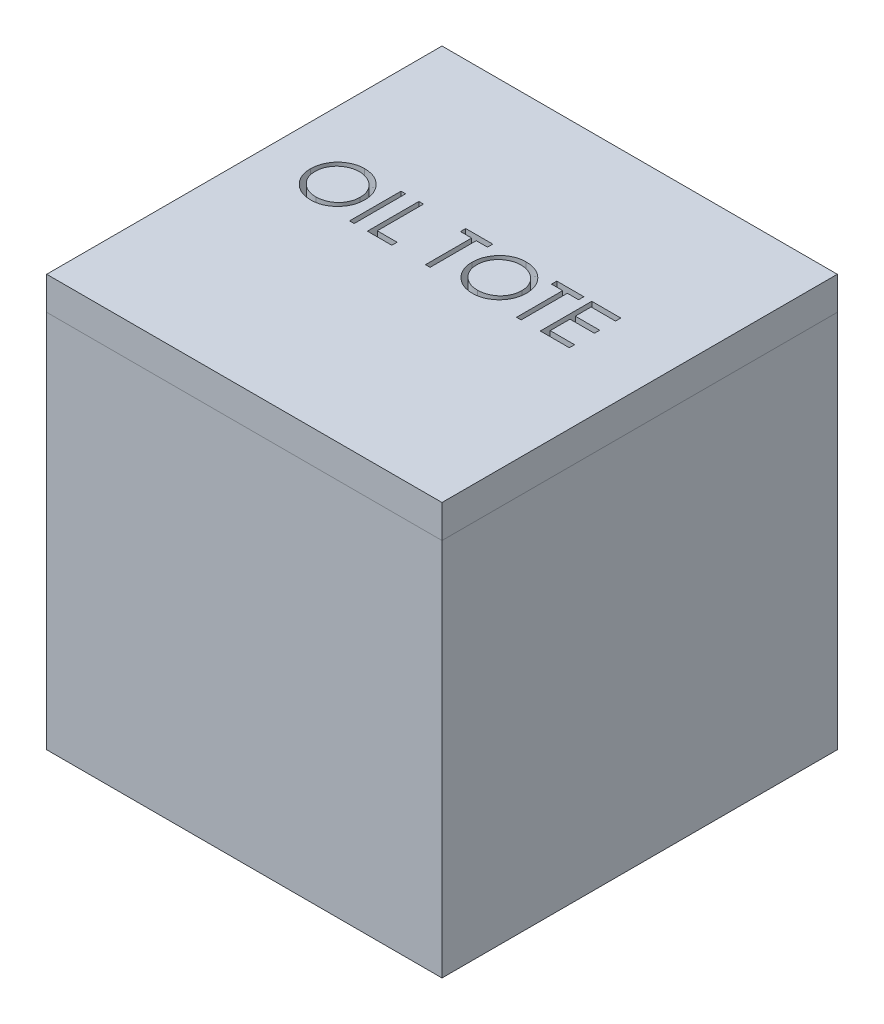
SolidWorks part; units mm, degrees
ref_plane "Front Plane" through (0, 0, 0) normal (0, 0, 1) x (1, 0, 0)
ref_plane "Top Plane" through (0, 0, 0) normal (0, 1, 0) x (1, 0, 0)
ref_plane "Right Plane" through (0, 0, 0) normal (1, 0, 0) x (0, 0, -1)
sketch "Sketch1" plane through (0, 0, 0) normal (0, 1, 0) x (1, 0, 0)
  line L0 (0, 609.6) -> (0, -609.6) construction
  line L1 (-609.6, 609.6) -> (609.6, 609.6)
  line L2 (-609.6, 609.6) -> (-609.6, -609.6)
  line L3 (-609.6, -609.6) -> (609.6, -609.6)
  line L4 (609.6, 609.6) -> (609.6, -609.6)
  dimension "D1" = 1219.2
extrude "Boss-Extrude1" add sketch "Sketch1" along normal blind 1168.4
sketch "Sketch2" plane through (0, 1168.4, 0) normal (0, 1, 0) x (1, 0, 0)
  line L4 (609.6, 609.6) -> (-609.6, 609.6)
  line L5 (609.6, -609.6) -> (609.6, 609.6)
  line L6 (-609.6, -609.6) -> (609.6, -609.6)
  line L7 (-609.6, 609.6) -> (-609.6, -609.6)
  line L8 (609.6, 609.6) -> (-609.6, 609.6)
  line L9 (609.6, -609.6) -> (609.6, 609.6)
  line L10 (-609.6, -609.6) -> (609.6, -609.6)
  line L11 (-609.6, 609.6) -> (-609.6, -609.6)
  dimension "D1" = 0
extrude "Boss-Extrude2" add sketch "Sketch2" along normal blind 101.6 separate body
sketch "Sketch3" plane through (0, 1270, 0) normal (0, 1, 0) x (1, 0, 0)
  line L0 (-496.7442, 0) -> (517.1584, 0) construction
  text T0 "OIL TOTE" font "Century Gothic" height in points 600
extrude "Cut-Extrude1" cut sketch "Sketch3" against normal blind 101.6
